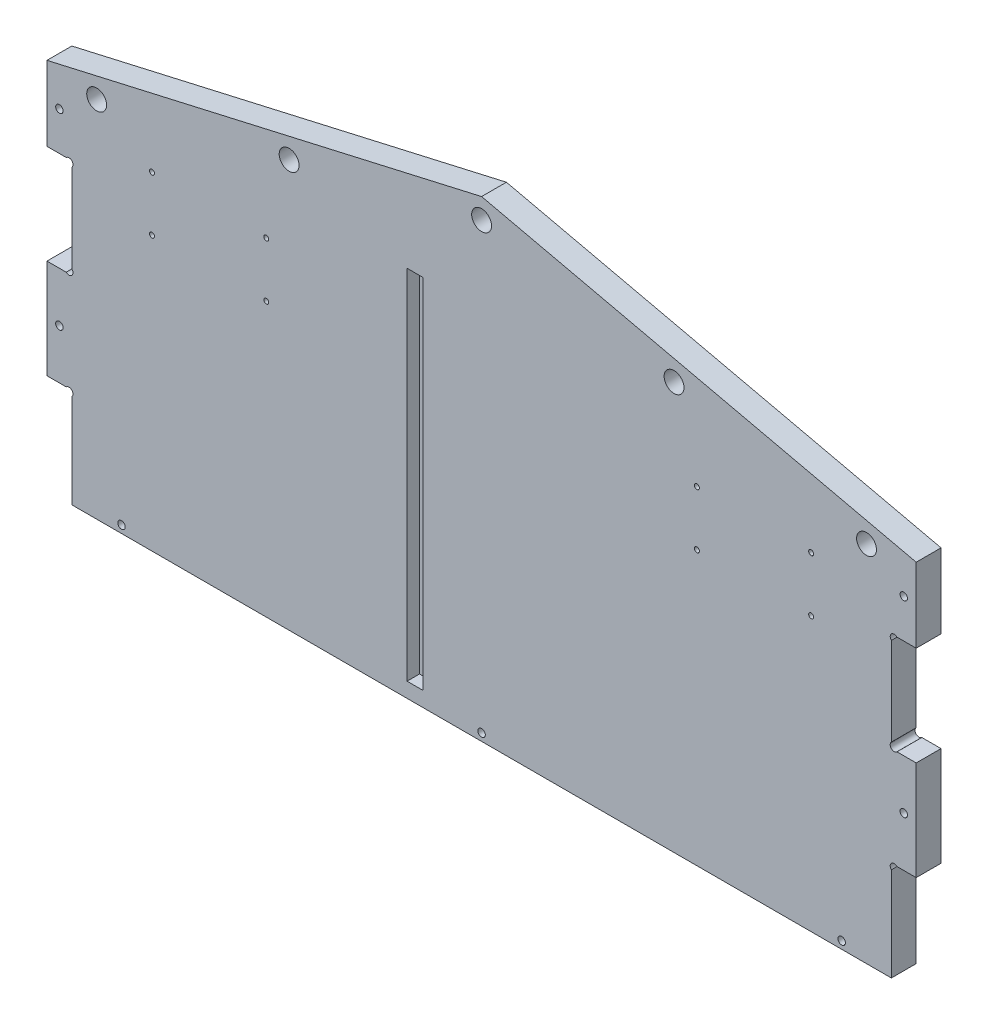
SolidWorks part; units mm, degrees
ref_plane "Plan de face" through (0, 0, 0) normal (0, 0, 1) x (1, 0, 0)
ref_plane "Plan de dessus" through (0, 0, 0) normal (0, 1, 0) x (1, 0, 0)
ref_plane "Plan de droite" through (0, 0, 0) normal (1, 0, 0) x (0, 0, -1)
sketch "Esquisse1" plane through (0, 0, 0) normal (0, 0, 1) x (1, 0, 0)
  line L0 (0, 40) -> (10, 40)
  line L1 (0, -55) -> (0, 55) construction
  line L2 (10, 40) -> (10, 0)
  line L3 (55, 0) -> (-55, 0) construction
  line L4 (10, 0) -> (340, 0)
  line L5 (340, 0) -> (340, 40)
  line L6 (340, 40) -> (350, 40)
  line L7 (350, 40) -> (350, 80)
  line L8 (350, 80) -> (340, 80)
  line L9 (340, 80) -> (340, 120)
  line L10 (340, 120) -> (350, 120)
  line L11 (350, 120) -> (350, 150)
  line L12 (350, 150) -> (175, 190)
  line L13 (175, 190) -> (0, 150)
  line L14 (0, 150) -> (0, 120)
  line L15 (0, 120) -> (10, 120)
  line L16 (10, 120) -> (10, 80)
  line L17 (10, 80) -> (0, 80)
  line L18 (0, 80) -> (0, 40)
  line L19 (175, 0) -> (175, 200) construction
  dimension "D1" = 350
  dimension "D2" = 10
  dimension "D3" = 150
  dimension "D4" = 30
extrude "Extrusion1" add sketch "Esquisse1" along normal blind 10
sketch "Esquisse4" plane through (0, 0, 10) normal (0, 0, 1) x (1, 0, 0)
  line L0 (8.8686, 38.8686) -> (8.8686, 118.8686) construction
  line L1 (340, 40) -> (343.3758, 36.6242) construction
  line L2 (340, 80) -> (349.5219, 89.5219) construction
  line L3 (340, 120) -> (350.1777, 109.8223) construction
  line L4 (10, 120) -> (3.4585, 113.4585) construction
  line L5 (10, 80) -> (-5.8114, 95.8114) construction
  line L6 (10, 40) -> (-0.2623, 29.7377) construction
  line L7 (340, 120) -> (350, 120) construction
  line L8 (10, 40) -> (10, 0) construction
  line L9 (10, 120) -> (10, 80) construction
  line L10 (350, 80) -> (340, 80) construction
  line L11 (340, 40) -> (350, 40) construction
  circle A0 centre (8.8686, 118.8686) radius 1.6
  circle A1 centre (8.8686, 81.1314) radius 1.6
  circle A2 centre (8.8686, 38.8686) radius 1.6
  circle A3 centre (341.1314, 118.8686) radius 1.6
  circle A4 centre (341.1314, 81.1314) radius 1.6
  circle A5 centre (341.1314, 38.8686) radius 1.6
  dimension "D1" = 3.2
  dimension "D2" = 45
  dimension "D3" = 45
  dimension "D4" = 45
  dimension "D5" = 45
  dimension "D6" = 45
extrude "Enlèv. mat.-Extru.1_enfourchement" cut sketch "Esquisse4" against normal through all
sketch "Esquisse5" plane through (0, 0, 10) normal (0, 0, 1) x (1, 0, 0)
  line L0 (10, 3) -> (340, 3) construction
  line L1 (10, 37.7373) -> (10, 0) construction
  line L2 (340, 0) -> (340, 37.7373) construction
  line L3 (10, 0) -> (340, 0) construction
  line L4 (175, 0) -> (175, 190) construction
  line L5 (320, 0) -> (320, 10) construction
  line L6 (30, 0) -> (30, 10) construction
  line L7 (350, 150) -> (175, 190) construction
  line L8 (5, 120) -> (5, 151.1429) construction
  line L9 (0, 120) -> (7.7373, 120) construction
  line L10 (175, 190) -> (0, 150) construction
  line L11 (0, 150) -> (0, 120) construction
  line L12 (345, 120) -> (345, 151.1429) construction
  line L13 (342.2627, 120) -> (350, 120) construction
  line L14 (350, 120) -> (350, 150) construction
  line L15 (5, 120) -> (5, 40) construction
  line L16 (0, 40) -> (7.7373, 40) construction
  line L17 (0, 60) -> (13.1298, 60) construction
  line L18 (0, 80) -> (0, 40) construction
  line L19 (345, 120) -> (345, 40) construction
  line L20 (342.2627, 40) -> (350, 40) construction
  line L21 (350, 60) -> (331.155, 60) construction
  line L22 (350, 40) -> (350, 80) construction
  circle A0 centre (30, 3) radius 1.5
  circle A1 centre (175, 3) radius 1.5
  circle A2 centre (320, 3) radius 1.5
  circle A3 centre (5, 135.5714) radius 1.5
  circle A4 centre (345, 135.5714) radius 1.5
  circle A5 centre (5, 60) radius 1.5
  circle A6 centre (345, 60) radius 1.5
  dimension "D4" = 3
  dimension "D1" = 3
  dimension "D2" = 20
  dimension "D3" = 20
  dimension "D5" = 5
  dimension "D6" = 5
extrude "Enlèv. mat.-Extru.2_fixation sol et murs" cut sketch "Esquisse5" against normal through all
sketch "Esquisse6" plane through (0, 0, 10) normal (0, 0, 1) x (1, 0, 0)
  line L0 (0, 141.7937) -> (175, 181.7937) construction
  line L1 (175, 181.7937) -> (350, 141.7937) construction
  line L2 (350, 150) -> (175, 190) construction
  line L3 (175, 190) -> (0, 150) construction
  line L4 (175, 190) -> (175, 0) construction
  line L5 (350, 120) -> (350, 150) construction
  line L6 (0, 150) -> (0, 120) construction
  line L7 (10, 0) -> (340, 0) construction
  circle A0 centre (175, 181.7937) radius 4
  circle A1 centre (330, 146.3651) radius 4
  circle A2 centre (20, 146.3651) radius 4
  circle A3 centre (252.5013, 164.0791) radius 4
  circle A4 centre (97.4987, 164.0791) radius 4
  dimension "D3" = 8
  dimension "D5" = 20
  dimension "D7" = 79.5
  dimension "D1" = 8
  dimension "D2" = 8
  dimension "D4" = 20
  dimension "D6" = 79.5
extrude "Enlèv. mat.-Extru.3_fixation cables" cut sketch "Esquisse6" against normal through all
sketch "Esquisse9" plane through (0, 0, 10) normal (0, 0, 1) x (1, 0, 0)
  line L0 (0, 80) -> (0, 40) construction
  line L1 (151.5, 150) -> (145, 150)
  line L2 (151.5, 150) -> (151.5, 6)
  line L3 (151.5, 6) -> (145, 6)
  line L4 (145, 150) -> (145, 6)
  line L5 (10, 0) -> (340, 0) construction
  dimension "D1" = 145
  dimension "D2" = 6.5
  dimension "D3" = 144
  dimension "D4" = 6
extrude "Enlèv. mat.-Extru.1" cut sketch "Esquisse9" against normal blind 5
sketch "Esquisse8" plane through (0, 0, 10) normal (0, 0, 1) x (1, 0, 0)
  line L0 (175, 0) -> (175, 190) construction
  line L1 (10, 0) -> (340, 0) construction
  line L2 (175, 190) -> (0, 150) construction
  line L3 (42.2974, 110.1776) -> (307.7026, 110.1776) construction
  line L4 (307.7026, 132.1776) -> (80.0085, 132.1776) construction
  line L7 (261.7026, 106.921) -> (261.7026, 144.576) construction
  line L8 (42.2974, 137.2503) -> (42.2974, 102.9621) construction
  line L9 (307.7026, 132.1776) -> (307.7026, 105.0986) construction
  circle A0 centre (261.7026, 132.1776) radius 1
  circle A1 centre (261.7026, 110.1776) radius 1
  circle A2 centre (88.2974, 110.1776) radius 1
  circle A3 centre (88.2974, 132.1776) radius 1
  circle A4 centre (42.2974, 132.1776) radius 1
  circle A5 centre (42.2974, 110.1776) radius 1
  circle A6 centre (307.7026, 132.1776) radius 1
  circle A7 centre (307.7026, 110.1776) radius 1
  dimension "D2" = 2
  dimension "D4" = 46
  dimension "D6" = 46
  dimension "D3" = 22
extrude "Enlèv. mat.-Extru.2" cut sketch "Esquisse8" against normal through all
sketch "Esquisse10" plane through (0, 0, 5) normal (0, 0, 1) x (1, 0, 0)
  line L0 (148.25, 150) -> (148.25, 6) construction
  line L1 (151.5, 150) -> (145, 150) construction
  line L2 (145, 6) -> (151.5, 6) construction
  line L3 (145, 78) -> (151.5, 78) construction
  line L4 (145, 150) -> (145, 6) construction
  line L5 (151.5, 6) -> (151.5, 150) construction
  line L6 (10, 0) -> (340, 0) construction
  circle A0 centre (148.25, 140) radius 1.5
  circle A1 centre (148.25, 78) radius 1.5
  circle A2 centre (148.25, 15) radius 1.5
  dimension "D3" = 3
  dimension "D1" = 10
  dimension "D2" = 15
extrude "Enlèv. mat.-Extru.3" cut sketch "Esquisse10" against normal through all
